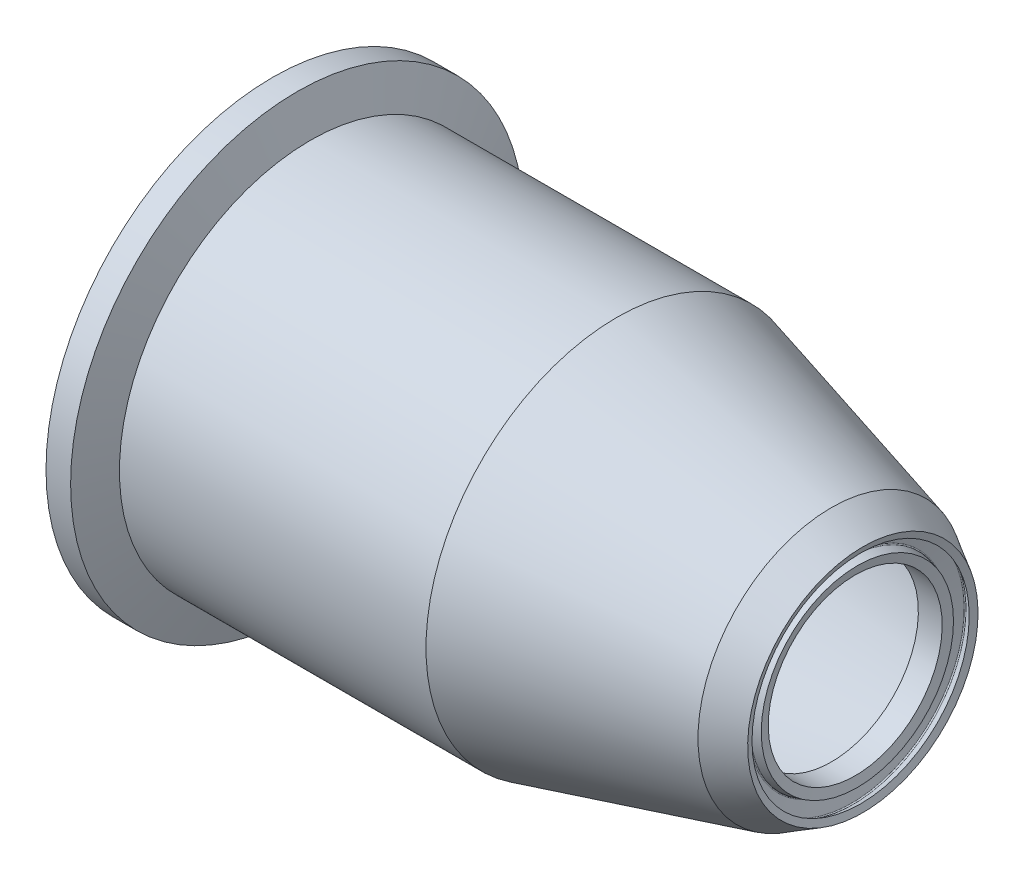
SolidWorks part; units mm, degrees
ref_plane "Front" through (0, 0, 0) normal (0, 0, 1) x (1, 0, 0)
ref_plane "Top" through (0, 0, 0) normal (0, 1, 0) x (1, 0, 0)
ref_plane "Right" through (0, 0, 0) normal (1, 0, 0) x (0, 0, -1)
sketch "Sketch1" plane through (0, 0, 0) normal (0, 0, 1) x (1, 0, 0)
  line L0 (0, 0) -> (-254, 0) construction
  line L1 (-254, 60.325) -> (-254, -60.325) construction
  line L2 (-254, 60.325) -> (-247.4468, 60.325)
  line L3 (-247.4468, 60.325) -> (-243.98, 50.8)
  line L4 (-256.3876, 47.625) -> (-162.8, 47.625)
  line L5 (-243.98, 50.8) -> (-162.382, 50.8)
  line L6 (-162.382, 50.8) -> (-105.2801, 35.4996)
  line L7 (-96.8962, 30.6592) -> (-97.4973, 28.9111)
  line L8 (-122.994, 5.7325) -> (-101.6, 0) construction
  line L9 (0, 0) -> (-253.8905, 105.1649) construction
  line L10 (-162.8, 47.625) -> (-105.2769, 32.2118)
  line L11 (-256.3876, 50.927) -> (-254, 50.927)
  line L12 (-254, 60.325) -> (-254, 55.6117)
  line L13 (-98.9269, 23.1521) -> (-105.2769, 23.1521)
  line L14 (-105.2769, 23.1521) -> (-105.2769, 32.2118)
  line L15 (-256.3876, 50.927) -> (-256.3876, 47.625)
  line L16 (0, 0) -> (-100.6431, 26.9672) construction
  line L17 (-97.4973, 28.9111) -> (-99.4839, 30.058)
  line L18 (-99.8562, 29.9038) -> (-100.7698, 26.4943)
  line L19 (-100.5902, 26.1832) -> (-98.3576, 25.585)
  line L20 (-98.3576, 25.585) -> (-98.9269, 23.1521)
  line L21 (-254, 55.6117) -> (-251.7543, 56.2134)
  line L22 (-254, 50.927) -> (-254, 52.1843)
  line L23 (-254, 52.1843) -> (-251.6886, 52.1843)
  line L24 (-251.4346, 55.9681) -> (-251.4346, 52.4383)
  line L25 (-105.2801, 35.4996) -> (-96.8962, 30.6592)
  circle A0 centre (-98.6735, 27.4972) radius 1.7653 construction
  circle A1 centre (0, 0) radius 101.6 construction
  arc A2 (-251.7543, 56.2134) -> (-251.4346, 55.9681) centre (-251.6886, 55.9681) cw
  arc A3 (-251.6886, 52.1843) -> (-251.4346, 52.4383) centre (-251.6886, 52.4383) ccw
  arc A4 (-99.8562, 29.9038) -> (-99.4839, 30.058) centre (-99.6109, 29.8381) cw
  arc A5 (-100.7698, 26.4943) -> (-100.5902, 26.1832) centre (-100.5245, 26.4286) ccw
  point P10 (-96.0796, 33.0343)
  point P22 (-251.4346, 56.2991)
  point P36 (-251.4346, 52.1843)
  point P39 (-99.7706, 30.2236)
  point P42 (-100.8356, 26.249)
  dimension "D21" = 203.2
  dimension "D26" = 3.5306
  dimension "D28" = 0.254
  dimension "D29" = 0.254
  dimension "D1" = 254
  dimension "D3" = 46.3042
  dimension "D4" = 15
  dimension "D5" = 3.175
  dimension "D6" = 2.3876
  dimension "D7" = 2.5654
  dimension "D8" = 66.675
  dimension "D9" = 101.6
  dimension "D10" = 101.854
  dimension "D11" = 22.5
  dimension "D12" = 104.3686
  dimension "D13" = 120.65
  dimension "D14" = 3.175
  dimension "D15" = 6.5532
  dimension "D16" = 70
  dimension "D17" = 6.35
  dimension "D18" = 4.1148
  dimension "D19" = 2.5654
  dimension "D20" = 51.1048
  dimension "D22" = 4.1148
  dimension "D23" = 6.2483
  dimension "D24" = 75
  dimension "D25" = 75
  dimension "D27" = 27.4972
  dimension "D30" = 3.9878
  dimension "D31" = 9.525
  dimension "D32" = 15
revolve "Revolve3" add sketch "Sketch1" angle 360 about L0
equation "\"D14@Sketch1\" = \"D5@Sketch1\""
